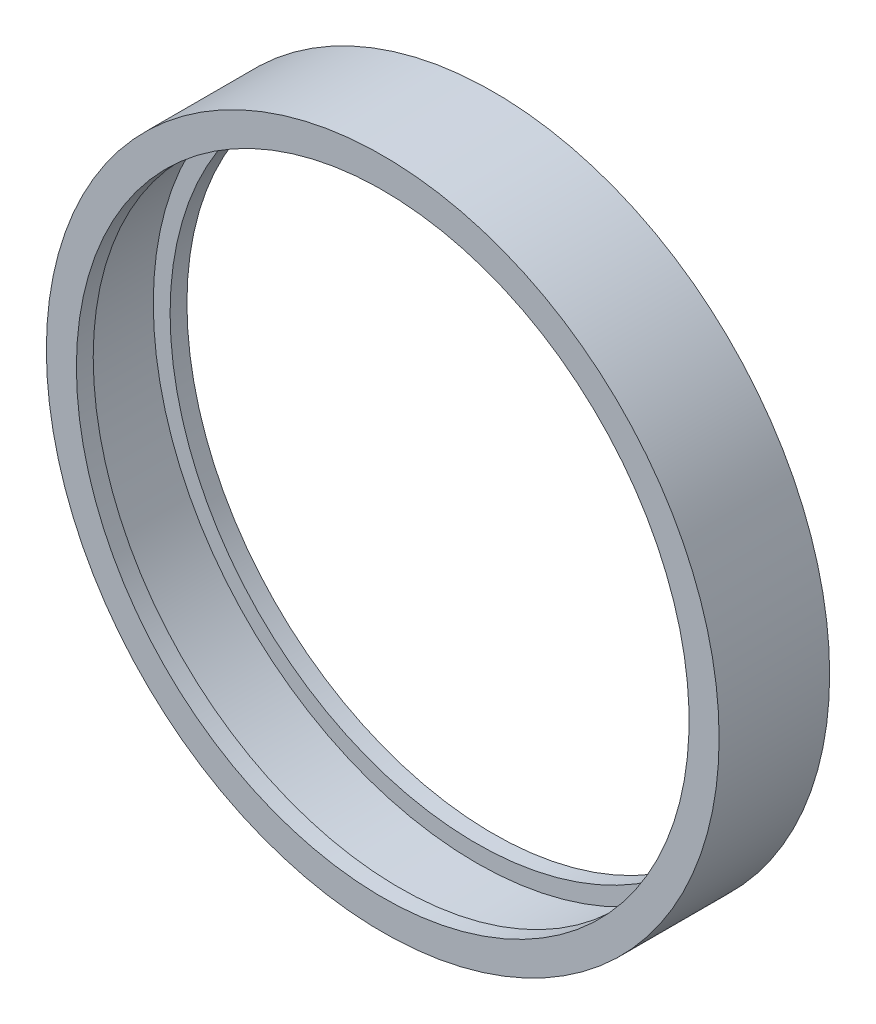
SolidWorks part; units mm, degrees
ref_plane "Front Plane" through (0, 0, 0) normal (0, 0, 1) x (1, 0, 0)
ref_plane "Top Plane" through (0, 0, 0) normal (0, 1, 0) x (1, 0, 0)
ref_plane "Right Plane" through (0, 0, 0) normal (1, 0, 0) x (0, 0, -1)
sketch "Sketch1" plane through (0, 0, 0) normal (0, 0, 1) x (1, 0, 0)
  circle A0 centre (0, 0) radius 140
  point P3 (-140, 0)
ref_plane "Plane1" through (-140, 0, 0) normal (0, -1, 0) x (1, 0, 0)
sketch "Sketch2" plane through (-140, 0, 0) normal (0, -1, 0) x (1, 0, 0)
  line L0 (0, 0) -> (0, 23)
  line L1 (0, 0) -> (0, -23)
  line L2 (0, 23) -> (5.5, 23)
  line L3 (5.5, 23) -> (12.5, 23)
  line L4 (12.5, 23) -> (12.5, 16)
  line L5 (12.5, 16) -> (5.5, 16)
  line L6 (5.5, 16) -> (5.5, -16)
  line L7 (5.5, -16) -> (12.5, -16)
  line L8 (12.5, -16) -> (12.5, -23)
  line L9 (12.5, -23) -> (0, -23)
sweep "Sweep1" add profiles "Sketch2" path "Sketch1"
